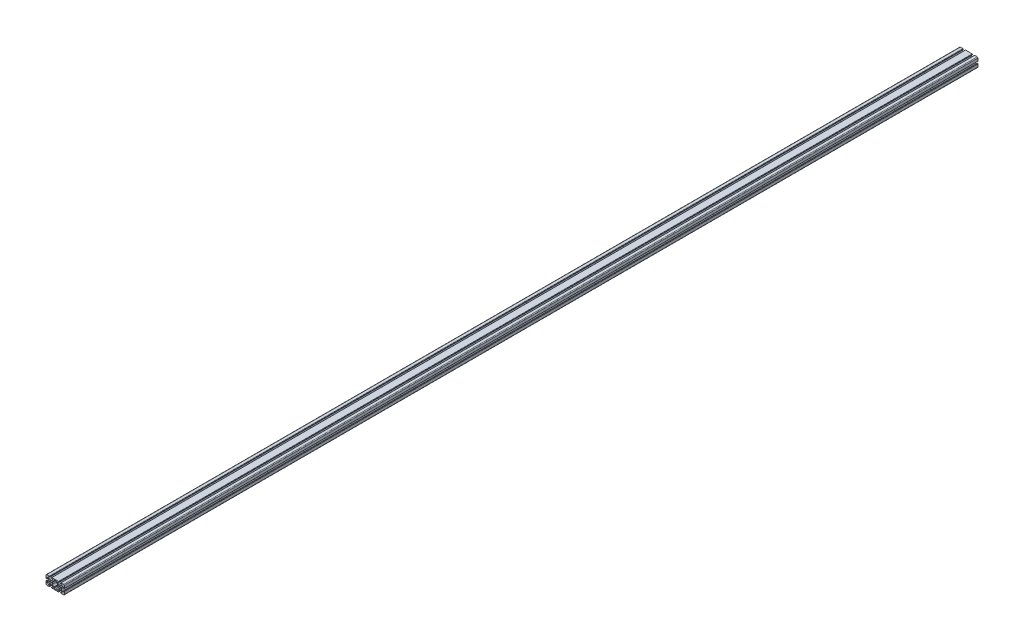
SolidWorks part; units mm, degrees
ref_plane "Front Plane" through (0, 0, 0) normal (0, 0, 1) x (1, 0, 0)
ref_plane "Top Plane" through (0, 0, 0) normal (0, 1, 0) x (1, 0, 0)
ref_plane "Right Plane" through (0, 0, 0) normal (1, 0, 0) x (0, 0, -1)
sketch "Sketch1" plane through (0, 0, 0) normal (0, 0, 1) x (1, 0, 0)
  line L0 (-14.3719, 20) -> (14.3719, 20)
  line L1 (-15.94, 17.1729) -> (-15.94, 18.3529)
  line L2 (-11.285, 15.68) -> (-14.37, 15.68)
  line L3 (-9.715, 13.6545) -> (-9.715, 14.11)
  line L4 (4.0718, 15.68) -> (-4.0718, 15.68)
  line L5 (-5.3418, 14.41) -> (-5.3418, 12.1296)
  line L6 (-5.7137, 11.2316) -> (-10.5988, 6.3465)
  line L7 (-12.2841, 3.2591) -> (-12.2841, -2.725)
  line L8 (5.991, -20) -> (-1.7801, -20)
  line L9 (0, 20) -> (0, -25.1394) construction
  line L10 (-4.0718, -15.68) -> (4.0718, -15.68)
  line L11 (-5.3418, -12.1296) -> (-5.3418, -14.41)
  line L12 (-11.2012, -5.7441) -> (-5.7137, -11.2316)
  line L13 (-42.275, 0) -> (43.1806, 0) construction
  line L14 (-9.9376, 13.1171) -> (-14.0919, 8.9628)
  line L15 (-17.4506, 7.7) -> (-22.5494, 7.7)
  line L16 (-25.9081, 8.9628) -> (-30.0624, 13.1171)
  line L17 (-30.285, 13.6545) -> (-30.285, 14.11)
  line L18 (-28.715, 15.68) -> (-25.63, 15.68)
  line L19 (-24.06, 17.25) -> (-24.06, 18.4312)
  line L20 (-25.5696, 20) -> (-33, 20)
  line L21 (-33, 20) -> (-36.83, 20)
  line L22 (-40, 16.8406) -> (-40, 13.0106)
  line L23 (-40, 13.0106) -> (-40, 5.5825)
  line L24 (-38.3243, 4.06) -> (-37.1443, 4.06)
  line L25 (-35.68, 5.6264) -> (-35.68, 8.7114)
  line L26 (-34.11, 10.2814) -> (-33.6509, 10.2814)
  line L27 (-33.1135, 10.0588) -> (-29.0111, 5.9564)
  line L28 (-27.7159, 2.571) -> (-27.7159, -2.502)
  line L29 (-28.9155, -5.8608) -> (-33.1719, -10.1172)
  line L30 (-33.7093, -10.3398) -> (-34.111, -10.3398)
  line L31 (-35.68, -8.715) -> (-35.68, -5.63)
  line L32 (-37.25, -4.06) -> (-38.43, -4.06)
  line L33 (-40, -5.5696) -> (-40, -13)
  line L34 (-40, -13) -> (-40, -16.83)
  line L35 (-37.0574, -20) -> (-33.2274, -20)
  line L36 (-33.2274, -20) -> (-25.797, -20)
  line L37 (-24.06, -18.4389) -> (-24.06, -17.25)
  line L38 (-25.63, -15.68) -> (-28.715, -15.68)
  line L39 (-30.285, -14.11) -> (-30.285, -13.6545)
  line L40 (-30.0624, -13.1171) -> (-26.3095, -9.3642)
  line L41 (-23.3415, -7.7) -> (-16.6585, -7.7)
  line L42 (-13.6905, -9.3642) -> (-9.9376, -13.1171)
  line L43 (-9.715, -13.6545) -> (-9.715, -14.11)
  line L44 (-11.285, -15.68) -> (-14.37, -15.68)
  line L45 (-15.94, -17.25) -> (-15.94, -18.43)
  line L46 (-14.37, -20) -> (-5.991, -20)
  line L47 (-5.991, -20) -> (-1.7801, -20)
  line L48 (14.37, -20) -> (5.991, -20)
  line L49 (15.94, -17.25) -> (15.94, -18.43)
  line L50 (11.285, -15.68) -> (14.37, -15.68)
  line L51 (9.715, -13.6545) -> (9.715, -14.11)
  line L52 (13.6905, -9.3642) -> (9.9376, -13.1171)
  line L53 (23.3415, -7.7) -> (16.6585, -7.7)
  line L54 (30.0624, -13.1171) -> (26.3095, -9.3642)
  line L55 (30.285, -14.11) -> (30.285, -13.6545)
  line L56 (25.63, -15.68) -> (28.715, -15.68)
  line L57 (24.06, -18.4389) -> (24.06, -17.25)
  line L58 (33.2274, -20) -> (25.797, -20)
  line L59 (37.0574, -20) -> (33.2274, -20)
  line L60 (40, -13) -> (40, -16.83)
  line L61 (40, -5.5696) -> (40, -13)
  line L62 (37.25, -4.06) -> (38.43, -4.06)
  line L63 (35.68, -8.715) -> (35.68, -5.63)
  line L64 (33.7093, -10.3398) -> (34.111, -10.3398)
  line L65 (28.9155, -5.8608) -> (33.1719, -10.1172)
  line L66 (27.7159, 2.571) -> (27.7159, -2.502)
  line L67 (33.1135, 10.0588) -> (29.0111, 5.9564)
  line L68 (34.11, 10.2814) -> (33.6509, 10.2814)
  line L69 (35.68, 5.6264) -> (35.68, 8.7114)
  line L70 (38.3243, 4.06) -> (37.1443, 4.06)
  line L71 (40, 13.0106) -> (40, 5.5825)
  line L72 (40, 16.8406) -> (40, 13.0106)
  line L73 (33, 20) -> (36.83, 20)
  line L74 (25.5696, 20) -> (33, 20)
  line L75 (24.06, 17.25) -> (24.06, 18.4312)
  line L76 (28.715, 15.68) -> (25.63, 15.68)
  line L77 (30.285, 13.6545) -> (30.285, 14.11)
  line L78 (25.9081, 8.9628) -> (30.0624, 13.1171)
  line L79 (17.4506, 7.7) -> (22.5494, 7.7)
  line L80 (9.9376, 13.1171) -> (14.0919, 8.9628)
  line L81 (11.2012, -5.7441) -> (5.7137, -11.2316)
  line L82 (5.3418, -12.1296) -> (5.3418, -14.41)
  line L83 (12.2841, 3.2591) -> (12.2841, -2.725)
  line L84 (5.7137, 11.2316) -> (10.5988, 6.3465)
  line L85 (5.3418, 14.41) -> (5.3418, 12.1296)
  line L86 (9.715, 13.6545) -> (9.715, 14.11)
  line L87 (11.285, 15.68) -> (14.37, 15.68)
  line L88 (15.94, 17.1729) -> (15.94, 18.3529)
  line L89 (-20, 24.8708) -> (-20, -18.43) construction
  line L90 (20, 29.4355) -> (20, -23.1087) construction
  line L91 (-3.0962, 16.9038) -> (-43.6857, -23.6857) construction
  line L92 (-36.2671, 16.2671) -> (-2.7875, -17.2125) construction
  arc A0 (-15.94, 18.3529) -> (-14.3719, 20) centre (-14.3719, 18.43) cw
  circle A1 centre (-20, 0) radius 3.4
  arc A2 (-14.37, 15.68) -> (-15.94, 17.1729) centre (-14.3719, 17.25) cw
  arc A3 (-11.285, 15.68) -> (-9.715, 14.11) centre (-11.285, 14.11) cw
  arc A4 (-9.715, 13.6545) -> (-9.9376, 13.1171) centre (-10.475, 13.6545) cw
  arc A5 (-12.2841, -2.725) -> (-11.2012, -5.7441) centre (-7.5341, -2.725) ccw
  arc A6 (-4.0718, 15.68) -> (-5.3418, 14.41) centre (-4.0718, 14.41) ccw
  arc A7 (-5.7137, 11.2316) -> (-5.3418, 12.1296) centre (-6.6118, 12.1296) ccw
  arc A8 (-10.5988, 6.3465) -> (-12.2841, 3.2591) centre (-7.5685, 2.6887) ccw
  arc A9 (-5.3418, -14.41) -> (-4.0718, -15.68) centre (-4.0718, -14.41) ccw
  arc A10 (-5.3418, -12.1296) -> (-5.7137, -11.2316) centre (-6.6118, -12.1296) ccw
  arc A11 (-17.4506, 7.7) -> (-14.0919, 8.9628) centre (-17.3191, 12.4482) ccw
  arc A12 (-25.9081, 8.9628) -> (-22.5494, 7.7) centre (-22.6809, 12.4482) ccw
  arc A13 (-30.285, 13.6545) -> (-30.0624, 13.1171) centre (-29.525, 13.6545) ccw
  arc A14 (-28.715, 15.68) -> (-30.285, 14.11) centre (-28.715, 14.11) ccw
  arc A15 (-25.63, 15.68) -> (-24.06, 17.25) centre (-25.63, 17.25) ccw
  arc A16 (-24.06, 18.4312) -> (-25.5696, 20) centre (-25.63, 18.4312) ccw
  arc A17 (-36.83, 20) -> (-40, 16.8406) centre (-36.83, 16.83) ccw
  arc A18 (-40, 5.5825) -> (-38.3243, 4.06) centre (-38.4306, 5.6264) ccw
  arc A19 (-37.1443, 4.06) -> (-35.68, 5.6264) centre (-37.25, 5.6264) ccw
  arc A20 (-34.11, 10.2814) -> (-35.68, 8.7114) centre (-34.11, 8.7114) ccw
  arc A21 (-33.1135, 10.0588) -> (-33.6509, 10.2814) centre (-33.6509, 9.5214) ccw
  arc A22 (-27.7159, 2.571) -> (-29.0111, 5.9564) centre (-32.4643, 2.6948) ccw
  arc A23 (-28.9155, -5.8608) -> (-27.7159, -2.502) centre (-32.4617, -2.7006) ccw
  arc A24 (-33.7093, -10.3398) -> (-33.1719, -10.1172) centre (-33.7093, -9.5798) ccw
  arc A25 (-35.68, -8.715) -> (-34.111, -10.3398) centre (-34.111, -8.7698) ccw
  arc A26 (-35.68, -5.63) -> (-37.25, -4.06) centre (-37.25, -5.63) ccw
  arc A27 (-38.43, -4.06) -> (-40, -5.5696) centre (-38.4312, -5.63) ccw
  arc A28 (-40, -16.83) -> (-37.0574, -20) centre (-36.83, -16.8382) ccw
  arc A29 (-25.797, -20) -> (-24.06, -18.4389) centre (-25.63, -18.4389) ccw
  arc A30 (-24.06, -17.25) -> (-25.63, -15.68) centre (-25.63, -17.25) ccw
  arc A31 (-30.285, -14.11) -> (-28.715, -15.68) centre (-28.715, -14.11) ccw
  arc A32 (-30.0624, -13.1171) -> (-30.285, -13.6545) centre (-29.525, -13.6545) ccw
  arc A33 (-23.3415, -7.7) -> (-26.3095, -9.3642) centre (-22.6565, -12.4003) ccw
  arc A34 (-13.6905, -9.3642) -> (-16.6585, -7.7) centre (-17.3435, -12.4003) ccw
  arc A35 (-9.715, -13.6545) -> (-9.9376, -13.1171) centre (-10.475, -13.6545) ccw
  arc A36 (-11.285, -15.68) -> (-9.715, -14.11) centre (-11.285, -14.11) ccw
  arc A37 (-14.37, -15.68) -> (-15.94, -17.25) centre (-14.37, -17.25) ccw
  arc A38 (-15.94, -18.43) -> (-14.37, -20) centre (-14.37, -18.43) ccw
  arc A39 (15.94, -18.43) -> (14.37, -20) centre (14.37, -18.43) cw
  arc A40 (14.37, -15.68) -> (15.94, -17.25) centre (14.37, -17.25) cw
  arc A41 (11.285, -15.68) -> (9.715, -14.11) centre (11.285, -14.11) cw
  arc A42 (9.715, -13.6545) -> (9.9376, -13.1171) centre (10.475, -13.6545) cw
  arc A43 (13.6905, -9.3642) -> (16.6585, -7.7) centre (17.3435, -12.4003) cw
  arc A44 (23.3415, -7.7) -> (26.3095, -9.3642) centre (22.6565, -12.4003) cw
  arc A45 (30.0624, -13.1171) -> (30.285, -13.6545) centre (29.525, -13.6545) cw
  arc A46 (30.285, -14.11) -> (28.715, -15.68) centre (28.715, -14.11) cw
  arc A47 (24.06, -17.25) -> (25.63, -15.68) centre (25.63, -17.25) cw
  arc A48 (25.797, -20) -> (24.06, -18.4389) centre (25.63, -18.4389) cw
  arc A49 (40, -16.83) -> (37.0574, -20) centre (36.83, -16.8382) cw
  arc A50 (38.43, -4.06) -> (40, -5.5696) centre (38.4312, -5.63) cw
  arc A51 (35.68, -5.63) -> (37.25, -4.06) centre (37.25, -5.63) cw
  arc A52 (35.68, -8.715) -> (34.111, -10.3398) centre (34.111, -8.7698) cw
  arc A53 (33.7093, -10.3398) -> (33.1719, -10.1172) centre (33.7093, -9.5798) cw
  arc A54 (28.9155, -5.8608) -> (27.7159, -2.502) centre (32.4617, -2.7006) cw
  arc A55 (27.7159, 2.571) -> (29.0111, 5.9564) centre (32.4643, 2.6948) cw
  arc A56 (33.1135, 10.0588) -> (33.6509, 10.2814) centre (33.6509, 9.5214) cw
  arc A57 (34.11, 10.2814) -> (35.68, 8.7114) centre (34.11, 8.7114) cw
  arc A58 (37.1443, 4.06) -> (35.68, 5.6264) centre (37.25, 5.6264) cw
  arc A59 (40, 5.5825) -> (38.3243, 4.06) centre (38.4306, 5.6264) cw
  arc A60 (36.83, 20) -> (40, 16.8406) centre (36.83, 16.83) cw
  arc A61 (24.06, 18.4312) -> (25.5696, 20) centre (25.63, 18.4312) cw
  arc A62 (25.63, 15.68) -> (24.06, 17.25) centre (25.63, 17.25) cw
  arc A63 (28.715, 15.68) -> (30.285, 14.11) centre (28.715, 14.11) cw
  arc A64 (30.285, 13.6545) -> (30.0624, 13.1171) centre (29.525, 13.6545) cw
  arc A65 (25.9081, 8.9628) -> (22.5494, 7.7) centre (22.6809, 12.4482) cw
  arc A66 (17.4506, 7.7) -> (14.0919, 8.9628) centre (17.3191, 12.4482) cw
  arc A67 (5.3418, -12.1296) -> (5.7137, -11.2316) centre (6.6118, -12.1296) cw
  arc A68 (5.3418, -14.41) -> (4.0718, -15.68) centre (4.0718, -14.41) cw
  arc A69 (10.5988, 6.3465) -> (12.2841, 3.2591) centre (7.5685, 2.6887) cw
  arc A70 (5.7137, 11.2316) -> (5.3418, 12.1296) centre (6.6118, 12.1296) cw
  arc A71 (4.0718, 15.68) -> (5.3418, 14.41) centre (4.0718, 14.41) cw
  arc A72 (12.2841, -2.725) -> (11.2012, -5.7441) centre (7.5341, -2.725) cw
  arc A73 (9.715, 13.6545) -> (9.9376, 13.1171) centre (10.475, 13.6545) ccw
  arc A74 (11.285, 15.68) -> (9.715, 14.11) centre (11.285, 14.11) ccw
  arc A75 (14.37, 15.68) -> (15.94, 17.1729) centre (14.3719, 17.25) ccw
  circle A76 centre (20, 0) radius 3.4
  arc A77 (15.94, 18.3529) -> (14.3719, 20) centre (14.3719, 18.43) ccw
  dimension "D4" = 6.8
  dimension "D1" = 80
  dimension "D2" = 40
  dimension "D3" = 20
  dimension "D5" = 8.12
  dimension "D6" = 4.32
  dimension "D7" = 20.57
  dimension "D8" = 4.32
  dimension "D9" = 8.12
  dimension "D10" = 12.3
  dimension "D11" = 4.32
  dimension "D12" = 4.32
  dimension "D13" = 4.32
extrude "Extrude1" add sketch "Sketch1" against normal blind 4000
